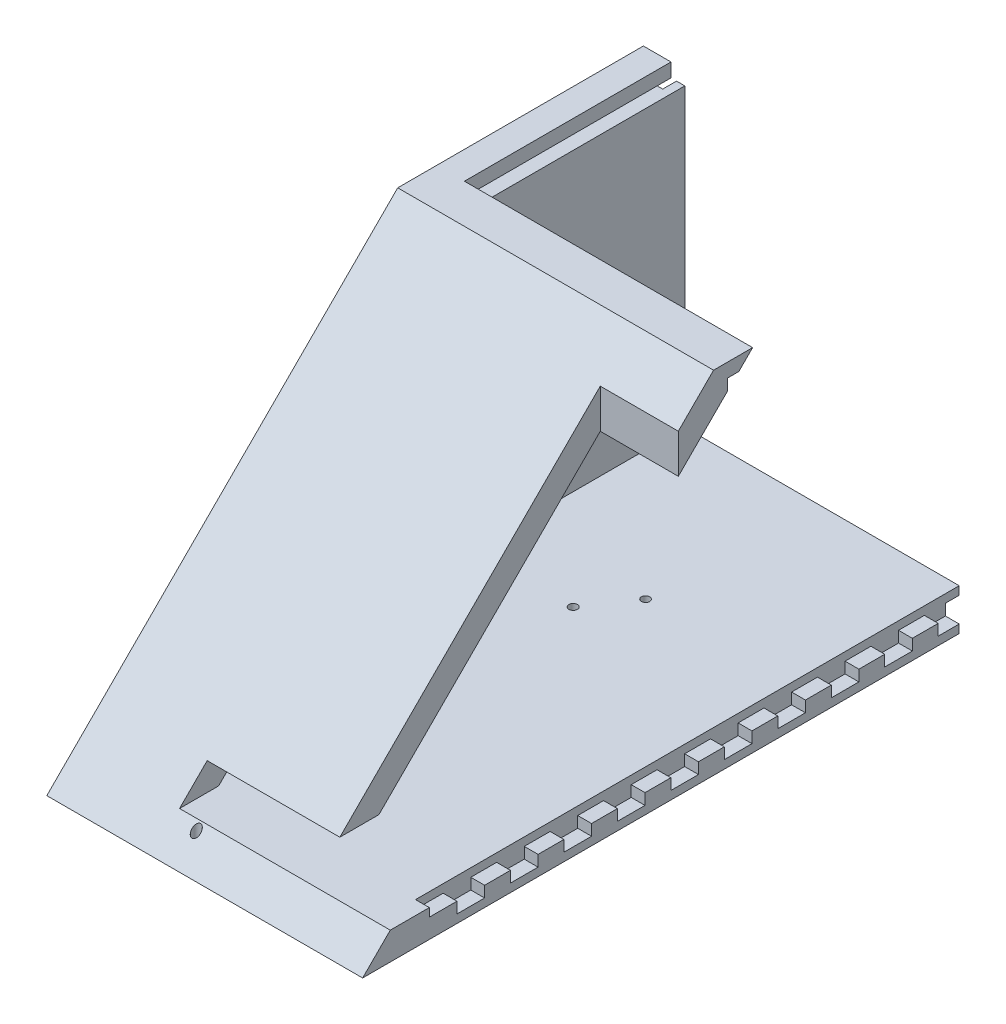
SolidWorks part; units mm, degrees
ref_plane "Front Plane" through (0, 0, 0) normal (0, 0, 1) x (1, 0, 0)
ref_plane "Top Plane" through (0, 0, 0) normal (0, 1, 0) x (1, 0, 0)
ref_plane "Right Plane" through (0, 0, 0) normal (1, 0, 0) x (0, 0, -1)
ref_plane "Metal_Det_Plane" through (0, 0, -5) normal (0, 0, -1) x (-1, 0, 0)
ref_plane "Center_Plane" through (0, 0, -215.9) normal (0, 0, -1) x (-1, 0, 0)
sketch "Centerline" plane through (0, 0, 0) normal (1, 0, 0) x (0, 0, -1)
  line L0 (-1000, 0) -> (49000, 0) construction
sketch "Sketch3" plane through (0, 0, 0) normal (1, 0, 0) x (0, 0, -1)
  line L3 (0, 0) -> (431.8, 0)
  line L4 (431.8, 0) -> (431.8, 127)
  line L5 (431.8, 127) -> (127, 127)
  line L6 (0, 0) -> (127, 127)
  point P3 (127, 0)
  point P4 (0, 0)
  dimension "D1" = 127
  dimension "D2" = 431.8
  dimension "D3" = 45
  dimension "D4" = 304.8
  dimension "D5" = 304.8
extrude "Boss-Extrude2" add sketch "Sketch3" along normal mid plane 228.6 contours L6 L5 L4 L3
shell "Shell2" thickness 10
sketch "Sketch4" plane through (0, 0, -431.8) normal (0, 0, -1) x (-1, 0, 0)
  line L0 (-104.3, 127) -> (-104.3, 122)
  line L1 (-114.3, 127) -> (114.3, 127) construction
  line L2 (-114.3, 127) -> (-114.3, 0) construction
  line L3 (-114.3, 0) -> (114.3, 0) construction
  line L4 (114.3, 127) -> (114.3, 0) construction
  line L5 (-114.3, 127) -> (114.3, 127) construction
  line L6 (-114.3, 127) -> (-114.3, 0) construction
  line L11 (-114.3, 0) -> (114.3, 0) construction
  line L13 (114.3, 127) -> (114.3, 0) construction
  line L14 (-114.3, 127) -> (114.3, 0) construction
  line L15 (-114.3, 0) -> (114.3, 127) construction
  line L16 (-104.3, 122) -> (-109.3, 122)
  line L17 (-109.3, 122) -> (-109.3, 117)
  line L18 (-109.3, 117) -> (-104.3, 117)
  line L19 (-104.3, 117) -> (-104.3, 10)
  line L20 (0, 0) -> (0, 127) construction
  line L21 (104.3, 10) -> (-104.3, 10)
  line L22 (104.3, 127) -> (104.3, 122)
  line L23 (104.3, 122) -> (109.3, 122)
  line L24 (109.3, 122) -> (109.3, 117)
  line L25 (109.3, 117) -> (104.3, 117)
  line L26 (104.3, 117) -> (104.3, 10)
  line L27 (-104.3, 117) -> (104.3, 117)
  line L28 (-104.3, 122) -> (104.3, 122)
  line L29 (-104.3, 127) -> (104.3, 127)
  point P8 (0, 63.5)
  point P20 (0, 63.5)
  point P24 (0, 10)
  dimension "D1" = 5
  dimension "D2" = 10
  dimension "D3" = 10
  dimension "D4" = 5
  dimension "D5" = 5
  dimension "D6" = 10
  dimension "D7" = 218.6
extrude "Cut-Extrude2" cut sketch "Sketch4" against normal blind 299.8 contours L27 L18 L17 L16 L28 L23 L24 L25
sketch "Sketch5" plane through (0, 0, -431.8) normal (0, 0, -1) x (-1, 0, 0)
  line L0 (-104.3, 122) -> (-104.3, 127)
  line L1 (-104.3, 127) -> (104.3, 127)
  line L2 (104.3, 127) -> (104.3, 122)
  line L3 (104.3, 122) -> (-104.3, 122)
extrude "Cut-Extrude3" cut sketch "Sketch5" against normal blind 10
ref_plane "Hardware_Surface Plane" through (0, 10, 0) normal (0, 1, 0) x (1, 0, 0)
sketch "Reference1 Base " plane through (0, 0, 0) normal (0, -1, 0) x (1, 0, 0)
  line L0 (76.2, 0) -> (-76.2, 0) construction
  line L1 (114.3, 0) -> (-114.3, 0) construction
  line L2 (-76.2, 0) -> (-76.2, -152.4) construction
  line L3 (-76.2, -152.4) -> (76.2, -152.4) construction
  line L4 (76.2, -152.4) -> (76.2, 0) construction
  line L5 (0, -69.85) -> (0, 69.85) construction
  circle A0 centre (-68.2, -144.4) radius 1.55
  circle A1 centre (-68.2, -8) radius 1.55
  circle A2 centre (68.2, -144.4) radius 1.55
  circle A3 centre (68.2, -8) radius 1.55
  point P6 (0, 0)
  dimension "D3" = 8
  dimension "D5" = 3.1
  dimension "D8" = 3.1
  dimension "D1" = 152.4
  dimension "D2" = 152.4
  dimension "D4" = 8
  dimension "D6" = 8
  dimension "D7" = 8
sketch "Reference2 Base" plane through (-114.3, 0, 0) normal (-1, 0, 0) x (0, 0, 1)
  line L0 (-10, 10) -> (-10, 0) construction
  line L1 (0, 0) -> (-127, 127) construction
  line L2 (-152.4, 0) -> (0, 0) construction
  dimension "D1" = 10
sketch "Reference3 Base" plane through (0, 0, 0) normal (0, 0.7071, 0.7071) x (1, 0, 0)
  line L0 (-114.3, 14.1421) -> (114.3, 14.1421) construction
  line L1 (114.3, 0) -> (114.3, 179.6051) construction
sketch "Base hole" plane through (0, 10, 0) normal (0, 1, 0) x (1, 0, 0)
  line L0 (-76.25, 10) -> (76.25, 10)
  line L1 (-76.25, 10) -> (-76.25, 162)
  line L2 (-76.25, 162) -> (76.25, 162)
  line L3 (76.25, 162) -> (76.25, 10)
  line L10 (-114.3, 10) -> (114.3, 10) construction
  line L12 (76.25, 162) -> (-76.25, 162) construction
  line L13 (76.25, 162) -> (76.25, 10) construction
  line L14 (76.25, 10) -> (-76.25, 10) construction
  line L15 (-76.25, 162) -> (-76.25, 10) construction
  line L16 (76.25, 162) -> (-76.25, 10) construction
  line L17 (76.25, 10) -> (-76.25, 162) construction
  point P3 (0, 10)
  point P6 (0, 86)
  dimension "D1" = 152.5
  dimension "D2" = 152
  dimension "D3" = 152
  dimension "D4" = 152.5
extrude "Cut-Extrude5" cut sketch "Base hole" along normal blind 10
sketch "Sketch16" plane through (0, 10, 0) normal (0, 1, 0) x (1, 0, 0)
  line L1 (-28.25, 114.25) -> (28.25, 114.25)
  line L2 (-28.25, 114.25) -> (-28.25, 57.75)
  line L3 (-28.25, 57.75) -> (28.25, 57.75)
  line L4 (28.25, 114.25) -> (28.25, 57.75)
  line L5 (-28.25, 114.25) -> (28.25, 57.75) construction
  line L6 (-28.25, 57.75) -> (28.25, 114.25) construction
  point P0 (0, 86)
  dimension "D1" = 56.5
  dimension "D2" = 56.5
extrude "Cut-Extrude7" cut sketch "Sketch16" along normal blind 120
sketch "Sketch17" plane through (0, 10, 0) normal (0, 1, 0) x (1, 0, 0)
  line L0 (-28.25, 57.75) -> (28.25, 57.75) construction
  line L1 (-28.25, 57.75) -> (28.25, 57.75)
  line L2 (-28.25, 57.75) -> (-28.25, 10)
  line L3 (-28.25, 10) -> (28.25, 10)
  line L4 (28.25, 57.75) -> (28.25, 10)
  line L6 (-28.25, 114.25) -> (-28.25, 57.75) construction
  line L7 (-114.3, 10) -> (114.3, 10) construction
  dimension "D1" = 56.5
extrude "Cut-Extrude8" cut sketch "Sketch17" along normal blind 120
ref_plane "Wall2 Plane" through (114.3, 0, 0) normal (1, 0, 0) x (0, 0, -1)
sketch "Sidewall_Motor_Tabs1" plane through (114.3, 0, 0) normal (1, 0, 0) x (0, 0, -1)
  line L0 (0, 0) -> (30, -30)
  line L1 (0, 0) -> (100, 0)
  line L3 (30, -30) -> (100, -30)
  line L4 (100, 0) -> (100, -30)
  line L5 (0, 0) -> (100, -30) construction
  line L6 (30, -30) -> (100, 0) construction
  line L8 (431.8, 0) -> (331.8, 0)
  line L9 (431.8, 0) -> (431.8, -30)
  line L10 (431.8, -30) -> (331.8, -30)
  line L11 (331.8, 0) -> (331.8, -30)
  line L12 (431.8, 0) -> (331.8, -30) construction
  line L13 (431.8, -30) -> (331.8, 0) construction
  point P4 (58.8235, -17.6471)
  point P13 (381.8, -15)
  dimension "D1" = 70
  dimension "D2" = 30
  dimension "D3" = 45
  dimension "D4" = 30
  dimension "D5" = 100
extrude "Motor_Mount_Wall1" add sketch "Sidewall_Motor_Tabs1" against normal blind 10
ref_plane "Wall1 Plane" through (-114.3, 0, 0) normal (-1, 0, 0) x (0, 0, 1)
sketch "Sidewall_Motor_Tabs2" plane through (-114.3, 0, 0) normal (-1, 0, 0) x (0, 0, 1)
  line L0 (0, 0) -> (-30, -30)
  line L1 (0, 0) -> (-100, 0)
  line L3 (-30, -30) -> (-100, -30)
  line L4 (-100, 0) -> (-100, -30)
  line L5 (0, 0) -> (-100, -30) construction
  line L6 (-30, -30) -> (-100, 0) construction
  line L8 (-431.8, 0) -> (-331.8, 0)
  line L9 (-431.8, 0) -> (-431.8, -30)
  line L10 (-431.8, -30) -> (-331.8, -30)
  line L11 (-331.8, 0) -> (-331.8, -30)
  line L12 (-431.8, 0) -> (-331.8, -30) construction
  line L13 (-431.8, -30) -> (-331.8, 0) construction
  point P4 (-58.8235, -17.6471)
  point P11 (-381.8, -15)
  dimension "D1" = 70
  dimension "D2" = 30
  dimension "D3" = 45
  dimension "D4" = 30
  dimension "D5" = 100
extrude "Motor_Mount_Wall2" add sketch "Sidewall_Motor_Tabs2" against normal blind 10
sketch "Side Wall Thickness Ref" plane through (-114.3, 0, 0) normal (-1, 0, 0) x (0, 0, 1)
  line L1 (-331.8, 0) -> (-100, 0) construction
  line L2 (-331.8, 0) -> (-331.8, 10) construction
  line L3 (-331.8, 10) -> (-100, 10) construction
  line L4 (-100, 0) -> (-100, 10) construction
  dimension "D1" = 10
sketch "Side Wall Thickness Ref1" plane through (0, 10, 0) normal (0, 1, 0) x (1, 0, 0)
  line L1 (-114.3, 331.8) -> (-104.3, 331.8) construction
  line L2 (-114.3, 331.8) -> (-114.3, 100) construction
  line L3 (-114.3, 100) -> (-104.3, 100) construction
  line L4 (-104.3, 331.8) -> (-104.3, 100) construction
  dimension "D1" = 10
sketch "Rear Slots" plane through (0, 10, 0) normal (0, 1, 0) x (1, 0, 0)
  line L0 (-94.3, 331.8) -> (-94.3, 303.8) construction
  line L1 (-86.8, 331.8) -> (-86.8, 303.8)
  line L2 (-101.8, 331.8) -> (-101.8, 303.8)
  line L3 (0, -69.85) -> (0, 69.85) construction
  line L4 (94.3, 331.8) -> (94.3, 303.8) construction
  line L5 (86.8, 331.8) -> (86.8, 303.8)
  line L6 (101.8, 331.8) -> (101.8, 303.8)
  arc A0 (-86.8, 331.8) -> (-101.8, 331.8) centre (-94.3, 331.8) ccw
  arc A1 (-101.8, 303.8) -> (-86.8, 303.8) centre (-94.3, 303.8) ccw
  arc A2 (86.8, 331.8) -> (101.8, 331.8) centre (94.3, 331.8) cw
  arc A3 (101.8, 303.8) -> (86.8, 303.8) centre (94.3, 303.8) cw
  point P2 (-94.3, 317.8)
  point P14 (94.3, 317.8)
  dimension "D2" = 28
  dimension "D1" = 15
  dimension "D3" = 10
extrude "Cut-Extrude_Rear Slots" cut sketch "Rear Slots" against normal blind 10
sketch "Front Slots" plane through (0, 10, 0) normal (0, 1, 0) x (1, 0, 0)
  line L0 (-94.3, 128) -> (-94.3, 100) construction
  line L1 (-86.8, 128) -> (-86.8, 100)
  line L2 (-101.8, 128) -> (-101.8, 100)
  line L3 (0, -69.85) -> (0, 69.85) construction
  line L4 (94.3, 128) -> (94.3, 100) construction
  line L5 (86.8, 128) -> (86.8, 100)
  line L6 (101.8, 128) -> (101.8, 100)
  arc A0 (-86.8, 128) -> (-101.8, 128) centre (-94.3, 128) ccw
  arc A1 (-101.8, 100) -> (-86.8, 100) centre (-94.3, 100) ccw
  arc A2 (86.8, 128) -> (101.8, 128) centre (94.3, 128) cw
  arc A3 (101.8, 100) -> (86.8, 100) centre (94.3, 100) cw
  point P2 (-94.3, 114)
  point P12 (94.3, 114)
  dimension "D1" = 15
  dimension "D2" = 28
  dimension "D3" = 10
extrude "Cut-Extrude_Front Slots" cut sketch "Front Slots" against normal blind 10
sketch "Sketch25" plane through (-114.3, 0, 0) normal (-1, 0, 0) x (0, 0, 1)
  line L0 (-331.8, -26.15) -> (-331.8, -3.85) construction
  line L1 (-331.8, 0) -> (-331.8, -30) construction
  line L2 (-331.8, -3.85) -> (-396.2, -3.85) construction
  line L3 (-396.2, -3.85) -> (-396.2, -26.15) construction
  line L4 (-396.2, -26.15) -> (-332.748, -26.15) construction
  line L5 (-331.8, -15) -> (-385.2, -15) construction
  line L6 (-365.1, -6.25) -> (-365.1, -23.75) construction
  line L7 (-215.9, 86.35) -> (-215.9, -86.35) construction
  line L8 (-66.7, -6.25) -> (-66.7, -23.75) construction
  line L9 (-100, -15) -> (-46.6, -15) construction
  line L10 (-35.6, -26.15) -> (-99.052, -26.15) construction
  line L11 (-35.6, -3.85) -> (-35.6, -26.15) construction
  line L12 (-100, -3.85) -> (-35.6, -3.85) construction
  line L13 (-100, -26.15) -> (-100, -3.85) construction
  circle A0 centre (-385.2, -15) radius 3
  circle A1 centre (-365.1, -6.25) radius 1.55
  circle A2 centre (-365.1, -23.75) radius 1.55
  circle A3 centre (-66.7, -23.75) radius 1.55
  circle A4 centre (-66.7, -6.25) radius 1.55
  circle A5 centre (-46.6, -15) radius 3
  point P5 (-331.8, -15)
  point P15 (-365.1, -15)
  point P31 (-66.7, -15)
  point P32 (-100, -15)
  dimension "D4" = 6
  dimension "D7" = 3.1
  dimension "D8" = 3.1
  dimension "D1" = 22.3
  dimension "D2" = 64.4
  dimension "D3" = 53.4
  dimension "D5" = 20.1
  dimension "D6" = 17.5
extrude "Motor_Holes" cut sketch "Sketch25" against normal through all
extrude "Cut-Extrude9" cut sketch "Reference1 Base " against normal blind 10
sketch "Sketch26" plane through (0, 0, 0) normal (0, -1, 0) x (1, 0, 0)
  line L0 (-76.2, -152.4) -> (76.2, -152.4) construction
  line L1 (-60.08, -157.4) -> (60.08, -157.4) construction
  line L2 (-60.08, -157.4) -> (-60.08, -277.56) construction
  line L3 (-60.08, -277.56) -> (60.08, -277.56) construction
  line L4 (60.08, -157.4) -> (60.08, -277.56) construction
  line L5 (-60.08, -157.4) -> (60.08, -277.56) construction
  line L6 (-60.08, -277.56) -> (60.08, -157.4) construction
  line L7 (-60.08, -282.56) -> (60.08, -282.56) construction
  line L8 (-60.08, -282.56) -> (-60.08, -402.72) construction
  line L11 (-60.08, -402.72) -> (60.08, -402.72) construction
  line L13 (0, -86.35) -> (0, 86.35) construction
  line L14 (60.08, -282.56) -> (60.08, -402.72) construction
  line L15 (-60.08, -282.56) -> (60.08, -402.72) construction
  line L16 (-60.08, -402.72) -> (60.08, -282.56) construction
  circle A0 centre (-57.54, -159.94) radius 1.5
  circle A1 centre (57.54, -159.94) radius 1.5
  circle A2 centre (-57.54, -275.02) radius 1.5
  circle A3 centre (57.54, -275.02) radius 1.5
  circle A4 centre (-57.54, -285.1) radius 1.5
  circle A6 centre (-57.54, -400.18) radius 1.5
  circle A8 centre (57.54, -285.1) radius 1.5
  circle A9 centre (57.54, -400.18) radius 1.5
  point P4 (0, -217.48)
  point P23 (0, -342.64)
  dimension "D7" = 3
  dimension "D10" = 2.54
  dimension "D12" = 3
  dimension "D13" = 3
  dimension "D4" = 120.16
  dimension "D17" = 3
  dimension "D1" = 120.16
  dimension "D2" = 120.16
  dimension "D3" = 5
  dimension "D5" = 120.16
  dimension "D6" = 2.54
  dimension "D8" = 2.54
  dimension "D9" = 2.54
  dimension "D11" = 2.54
  dimension "D14" = 2.54
  dimension "D15" = 2.54
  dimension "D16" = 2.54
  dimension "D18" = 5
extrude "Cut-Extrude_TowerBase_Holes" cut sketch "Sketch26" against normal blind 10
sketch "Sketch27" plane through (0, 0, 0) normal (1, 0, 0) x (0, 0, -1)
  line L0 (431.8, -30) -> (331.8, -30) construction
  line L1 (431.8, 127) -> (0, 127)
  line L2 (431.8, 127) -> (431.8, -30)
  line L3 (431.8, -30) -> (0, -30)
  line L4 (0, 127) -> (0, -30)
  point P6 (0, 0)
  point P7 (0, 0)
extrude "Cut-Extrude10" cut sketch "Sketch27" along normal through all
sketch "Sketch28" plane through (0, 0, 0) normal (1, 0, 0) x (0, 0, -1)
  line L0 (421.8, 10) -> (10, 10) construction
  line L1 (24.1421, 10) -> (421.8, 10)
  line L2 (24.1421, 10) -> (24.1421, 7)
  line L3 (24.1421, 7) -> (424.8, 7)
  line L6 (421.8, 117) -> (424.8, 117)
  line L7 (421.8, 117) -> (421.8, 10)
  line L9 (424.8, 117) -> (424.8, 7)
  point P1 (0, 0)
  point P5 (0, 0)
  point P6 (424.8, 4.9136)
  point P10 (0, 0)
  point P12 (0, 0)
  point P13 (0, 0)
  point P14 (426.7475, 7)
  dimension "D1" = 3
  dimension "D2" = 3
extrude "Cut-Extrude11" cut sketch "Sketch28" against normal blind 5 contours L6 L9 L3 L2 L1 L7
sketch "Sketch31" plane through (0, 0, 0) normal (1, 0, 0) x (0, 0, -1)
  line L6 (424.8, 20) -> (428.8, 20)
  line L84 (401.8, 7) -> (411.8, 7)
  line L85 (401.8, 7) -> (401.8, 3)
  line L86 (401.8, 3) -> (411.8, 3)
  line L87 (411.8, 7) -> (411.8, 3)
  line L89 (431.8, 0) -> (0, 0) construction
  line L90 (382.4496, 7) -> (382.4496, 3)
  line L91 (382.4496, 7) -> (392.4496, 7)
  line L92 (392.4496, 7) -> (392.4496, 3)
  line L93 (382.4496, 3) -> (392.4496, 3)
  line L94 (363.0992, 7) -> (363.0992, 3)
  line L95 (363.0992, 7) -> (373.0992, 7)
  line L96 (373.0992, 7) -> (373.0992, 3)
  line L97 (363.0992, 3) -> (373.0992, 3)
  line L98 (343.7488, 7) -> (343.7488, 3)
  line L99 (343.7488, 7) -> (353.7488, 7)
  line L100 (353.7488, 7) -> (353.7488, 3)
  line L101 (343.7488, 3) -> (353.7488, 3)
  line L102 (324.3983, 7) -> (324.3983, 3)
  line L103 (324.3983, 7) -> (334.3983, 7)
  line L104 (334.3983, 7) -> (334.3983, 3)
  line L105 (324.3983, 3) -> (334.3983, 3)
  line L106 (305.0479, 7) -> (305.0479, 3)
  line L107 (305.0479, 7) -> (315.0479, 7)
  line L108 (315.0479, 7) -> (315.0479, 3)
  line L109 (305.0479, 3) -> (315.0479, 3)
  line L110 (285.6975, 7) -> (285.6975, 3)
  line L111 (285.6975, 7) -> (295.6975, 7)
  line L112 (295.6975, 7) -> (295.6975, 3)
  line L113 (285.6975, 3) -> (295.6975, 3)
  line L114 (266.3471, 7) -> (266.3471, 3)
  line L115 (266.3471, 7) -> (276.3471, 7)
  line L116 (276.3471, 7) -> (276.3471, 3)
  line L117 (266.3471, 3) -> (276.3471, 3)
  line L118 (246.9967, 7) -> (246.9967, 3)
  line L119 (246.9967, 7) -> (256.9967, 7)
  line L120 (256.9967, 7) -> (256.9967, 3)
  line L121 (246.9967, 3) -> (256.9967, 3)
  line L122 (227.6463, 7) -> (227.6463, 3)
  line L123 (227.6463, 7) -> (237.6463, 7)
  line L124 (237.6463, 7) -> (237.6463, 3)
  line L125 (227.6463, 3) -> (237.6463, 3)
  line L126 (208.2959, 7) -> (208.2959, 3)
  line L127 (208.2959, 7) -> (218.2959, 7)
  line L128 (218.2959, 7) -> (218.2959, 3)
  line L129 (208.2959, 3) -> (218.2959, 3)
  line L130 (188.9454, 7) -> (188.9454, 3)
  line L131 (188.9454, 7) -> (198.9454, 7)
  line L132 (198.9454, 7) -> (198.9454, 3)
  line L133 (188.9454, 3) -> (198.9454, 3)
  line L134 (169.595, 7) -> (169.595, 3)
  line L135 (169.595, 7) -> (179.595, 7)
  line L136 (179.595, 7) -> (179.595, 3)
  line L137 (169.595, 3) -> (179.595, 3)
  line L138 (150.2446, 7) -> (150.2446, 3)
  line L139 (150.2446, 7) -> (160.2446, 7)
  line L140 (160.2446, 7) -> (160.2446, 3)
  line L141 (150.2446, 3) -> (160.2446, 3)
  line L142 (130.8942, 7) -> (130.8942, 3)
  line L143 (130.8942, 7) -> (140.8942, 7)
  line L144 (140.8942, 7) -> (140.8942, 3)
  line L145 (130.8942, 3) -> (140.8942, 3)
  line L146 (111.5438, 7) -> (111.5438, 3)
  line L147 (111.5438, 7) -> (121.5438, 7)
  line L148 (121.5438, 7) -> (121.5438, 3)
  line L149 (111.5438, 3) -> (121.5438, 3)
  line L150 (92.1934, 7) -> (92.1934, 3)
  line L151 (92.1934, 7) -> (102.1934, 7)
  line L152 (102.1934, 7) -> (102.1934, 3)
  line L153 (92.1934, 3) -> (102.1934, 3)
  line L154 (72.843, 7) -> (72.843, 3)
  line L155 (72.843, 7) -> (82.843, 7)
  line L156 (82.843, 7) -> (82.843, 3)
  line L157 (72.843, 3) -> (82.843, 3)
  line L158 (53.4925, 7) -> (53.4925, 3)
  line L159 (53.4925, 7) -> (63.4925, 7)
  line L160 (63.4925, 7) -> (63.4925, 3)
  line L161 (53.4925, 3) -> (63.4925, 3)
  line L162 (34.1421, 7) -> (34.1421, 3)
  line L163 (34.1421, 7) -> (44.1421, 7)
  line L164 (44.1421, 7) -> (44.1421, 3)
  line L165 (34.1421, 3) -> (44.1421, 3)
  line L166 (424.8, 20) -> (424.8, 30)
  line L167 (424.8, 30) -> (428.8, 30)
  line L168 (428.8, 20) -> (428.8, 30)
  line L169 (431.8, 0) -> (431.8, 117) construction
  line L170 (424.8, 36.75) -> (424.8, 46.75)
  line L171 (424.8, 36.75) -> (428.8, 36.75)
  line L172 (428.8, 36.75) -> (428.8, 46.75)
  line L173 (424.8, 46.75) -> (428.8, 46.75)
  line L174 (424.8, 53.5) -> (424.8, 63.5)
  line L175 (424.8, 53.5) -> (428.8, 53.5)
  line L176 (428.8, 53.5) -> (428.8, 63.5)
  line L177 (424.8, 63.5) -> (428.8, 63.5)
  line L178 (424.8, 70.25) -> (424.8, 80.25)
  line L179 (424.8, 70.25) -> (428.8, 70.25)
  line L180 (428.8, 70.25) -> (428.8, 80.25)
  line L181 (424.8, 80.25) -> (428.8, 80.25)
  line L182 (424.8, 87) -> (424.8, 97)
  line L183 (424.8, 87) -> (428.8, 87)
  line L184 (428.8, 87) -> (428.8, 97)
  line L185 (424.8, 97) -> (428.8, 97)
  line L186 (424.8, 117) -> (431.8, 117) construction
  line L189 (24.1421, 7) -> (424.8, 7) construction
  line L190 (421.8, 117) -> (421.8, 10) construction
  line L191 (24.1421, 10) -> (421.8, 10) construction
  line L192 (424.8, 117) -> (424.8, 7) construction
  point P116 (0, 0)
  dimension "D2" = 10
  dimension "D4" = 20
  dimension "D5" = 10
  dimension "D3" = 3
  dimension "D6" = 10
  dimension "D7" = 10
  dimension "D8" = 3
  dimension "D10" = 20
  dimension "D11" = 10
  dimension "D9" = 5
extrude "Cut-Extrude12" cut sketch "Sketch31" against normal blind 5 contours L85 L84 L87 L86 | L178 L181 L180 L179 | L174 L177 L176 L175 | L170 L173 L172 L171 | L166 L6 L168 L167 | L90 L93 L92 L91 | L98 L101 L100 L99 | L102 L105 L104 L103 | L94 L97 L96 L95 | L106 L109 L108 L107 | L110 L113 L112 L111 | L114 L117 L116 L115 | L118 L121 L120 L119 | L122 L125 L124 L123 | L126 L129 L128 L127 | L130 L133 L132 L131 | L134 L137 L136 L135 | L138 L141 L140 L139 | L142 L145 L144 L143 | L146 L149 L148 L147 | L150 L153 L152 L151 | L154 L157 L156 L155 | L158 L161 L160 L159 | L162 L165 L164 L163 | L182 L185 L184 L183
ref_plane "Plane1" through (0, 0, -215.9) normal (0, 0, 1) x (1, 0, 0)
sketch "Sketch33" plane through (0, 0, -215.9) normal (0, 0, 1) x (1, 0, 0)
  line L0 (-104.3, -30) -> (-114.3, -30) construction
  line L1 (-114.3, 127) -> (0, 127)
  line L2 (-114.3, 127) -> (-114.3, -30)
  line L3 (-114.3, -30) -> (0, -30)
  line L4 (0, 127) -> (0, -30)
  line L5 (0, 127) -> (0, 114.25) construction
extrude "Cut-Extrude13" cut sketch "Sketch33" against normal through all
sketch "Sketch34" plane through (0, 0, -215.9) normal (0, 0, -1) x (-1, 0, 0)
  line L1 (5, 10) -> (104.3, 10)
  line L2 (5, 10) -> (5, 7)
  line L3 (5, 7) -> (107.3, 7)
  line L5 (104.3, 117) -> (107.3, 117)
  line L6 (104.3, 117) -> (104.3, 10)
  line L8 (107.3, 117) -> (107.3, 7)
  point P3 (0, 0)
  dimension "D1" = 3
  dimension "D2" = 3
extrude "Boss-Extrude3" add sketch "Sketch34" along normal blind 5
sketch "Sketch35" plane through (0, 0, -215.9) normal (0, 0, -1) x (-1, 0, 0)
  line L0 (5, 7) -> (107.3, 7) construction
  line L1 (94.3, 7) -> (84.3, 7)
  line L2 (94.3, 7) -> (94.3, 3)
  line L3 (94.3, 3) -> (84.3, 3)
  line L4 (84.3, 7) -> (84.3, 3)
  line L5 (107.3, 7) -> (107.3, 117) construction
  line L6 (107.3, 20) -> (111.3, 20)
  line L7 (107.3, 20) -> (107.3, 30)
  line L8 (107.3, 30) -> (111.3, 30)
  line L9 (111.3, 20) -> (111.3, 30)
  line L10 (114.3, 0) -> (0, 0) construction
  line L11 (114.3, 127) -> (114.3, 0) construction
  line L12 (71.2, 7) -> (71.2, 3)
  line L13 (71.2, 7) -> (61.2, 7)
  line L14 (61.2, 7) -> (61.2, 3)
  line L15 (71.2, 3) -> (61.2, 3)
  line L16 (48.1, 7) -> (48.1, 3)
  line L17 (48.1, 7) -> (38.1, 7)
  line L18 (38.1, 7) -> (38.1, 3)
  line L19 (48.1, 3) -> (38.1, 3)
  line L20 (25, 7) -> (25, 3)
  line L21 (25, 7) -> (15, 7)
  line L22 (15, 7) -> (15, 3)
  line L23 (25, 3) -> (15, 3)
  line L24 (5, 10) -> (5, 7) construction
  line L25 (107.3, 39.25) -> (107.3, 49.25)
  line L26 (107.3, 39.25) -> (111.3, 39.25)
  line L27 (111.3, 39.25) -> (111.3, 49.25)
  line L28 (107.3, 49.25) -> (111.3, 49.25)
  line L29 (107.3, 58.5) -> (107.3, 68.5)
  line L30 (107.3, 58.5) -> (111.3, 58.5)
  line L31 (111.3, 58.5) -> (111.3, 68.5)
  line L32 (107.3, 68.5) -> (111.3, 68.5)
  line L33 (107.3, 77.75) -> (107.3, 87.75)
  line L34 (107.3, 77.75) -> (111.3, 77.75)
  line L35 (111.3, 77.75) -> (111.3, 87.75)
  line L36 (107.3, 87.75) -> (111.3, 87.75)
  line L37 (107.3, 97) -> (107.3, 107)
  line L38 (107.3, 97) -> (111.3, 97)
  line L39 (111.3, 97) -> (111.3, 107)
  line L40 (107.3, 107) -> (111.3, 107)
  line L41 (107.3, 117) -> (104.3, 117) construction
  dimension "D1" = 3
  dimension "D2" = 10
  dimension "D3" = 10
  dimension "D4" = 10
  dimension "D5" = 3
  dimension "D6" = 10
  dimension "D8" = 10
  dimension "D10" = 10
  dimension "D7" = 4
  dimension "D9" = 5
extrude "Boss-Extrude4" add sketch "Sketch35" along normal blind 5
